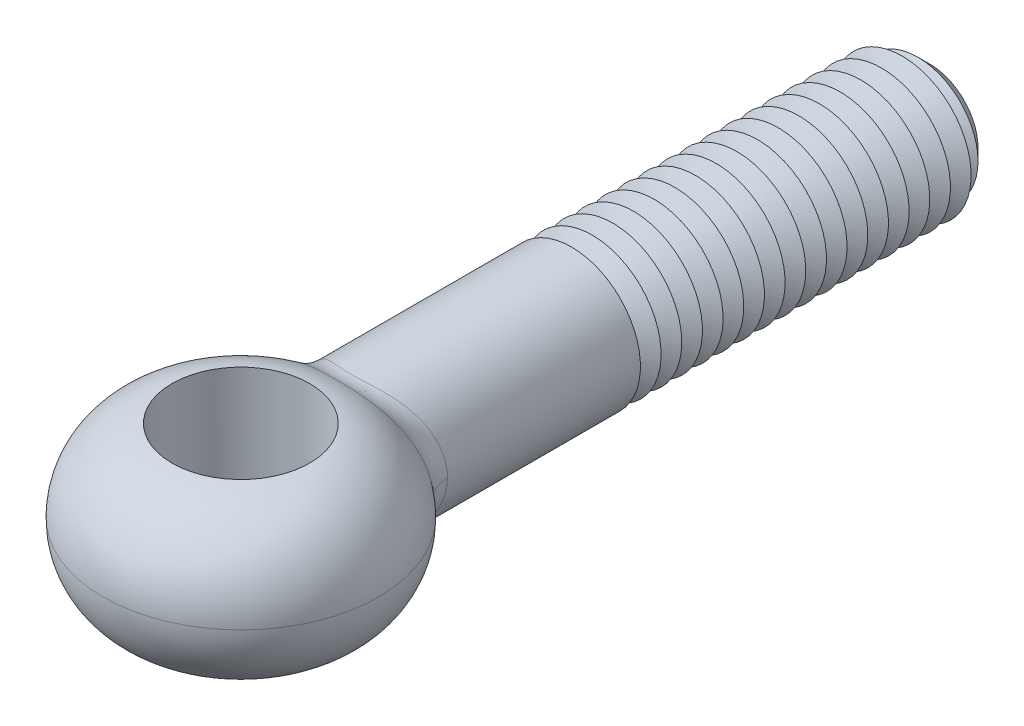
SolidWorks part; units mm, degrees
ref_plane "Front Plane" through (0, 0, 0) normal (0, 0, 1) x (1, 0, 0)
ref_plane "Top Plane" through (0, 0, 0) normal (0, 1, 0) x (1, 0, 0)
ref_plane "Right Plane" through (0, 0, 0) normal (1, 0, 0) x (0, 0, -1)
sketch "Sketch7" plane through (0, 0, 0) normal (0, 1, 0) x (1, 0, 0)
  circle A0 centre (0, 0) radius 10
  dimension "D1" = 20
extrude "Boss-Extrude3" add sketch "Sketch7" along normal mid plane 12
sketch "Sketch8" plane through (0, 0, 0) normal (0, 0, 1) x (1, 0, 0)
  circle A0 centre (0, 0) radius 5
  dimension "D1" = 10
extrude "Boss-Extrude4" add sketch "Sketch8" against normal blind 50
fillet "Fillet5" radius 6 2 edges at (0, -6, 10) (0, 6, 10)
fillet "Fillet6" radius 2.5 2 edges at (-0.0154, -5, -7.3166) (0.0154, 5, -7.3166)
chamfer "Chamfer1" distance 1.5 angle 45 1 edges at (5, 0, -50)
sketch "Sketch10" plane through (0, 0, 0) normal (0, 1, 0) x (1, 0, 0)
  line L0 (0, 28.1405) -> (0, -7.9233) construction
sketch "Sketch11" plane through (0, 0, 0) normal (0, 1, 0) x (1, 0, 0)
  line L0 (-5, 24) -> (-3.701, 24.75)
  line L1 (-5, 48.5) -> (-5, 10) construction
  line L2 (-3.701, 24.75) -> (-5, 25.5)
  line L3 (-5, 25.5) -> (-5, 24)
  line L4 (3.5, 50) -> (-3.5, 50) construction
  dimension "D1" = 1.5
  dimension "D2" = 26
revolve "Cut-Revolve1" cut sketch "Sketch11" angle 360 about L0
pattern_linear "LPattern1" count 17 spacing 1.5 along (0, 0, -1) of "Cut-Revolve1"
sketch "Sketch12" plane through (0, 0, 0) normal (0, 1, 0) x (1, 0, 0)
  circle A0 centre (0, 0) radius 5
  dimension "D1" = 10
extrude "Cut-Extrude1" cut sketch "Sketch12" against normal mid plane 12
